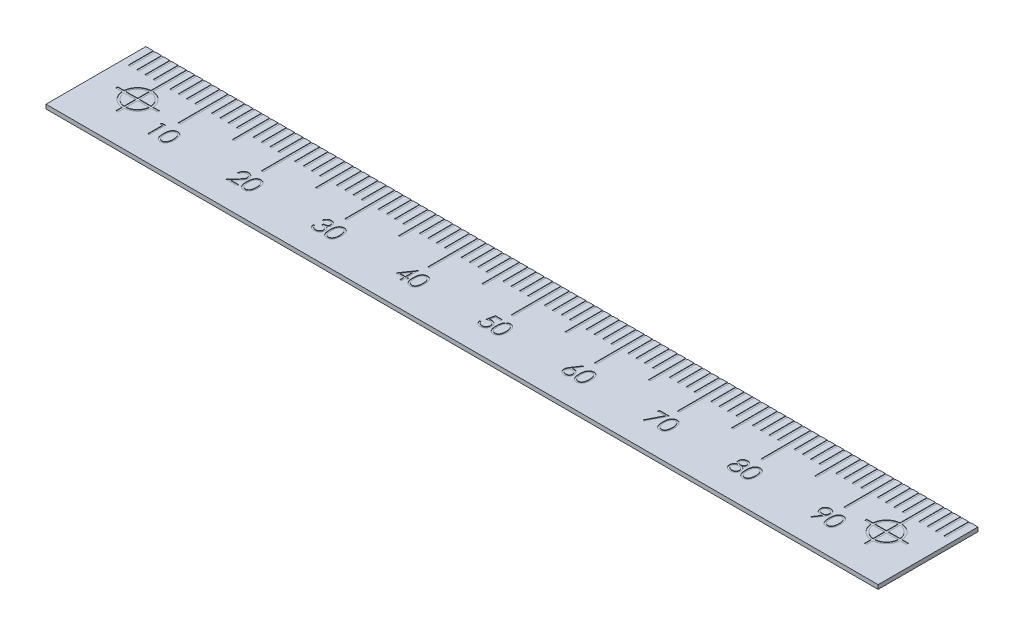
SolidWorks part; units mm, degrees
ref_plane "Front Plane" through (0, 0, 0) normal (0, 0, 1) x (1, 0, 0)
ref_plane "Top Plane" through (0, 0, 0) normal (0, 1, 0) x (1, 0, 0)
ref_plane "Right Plane" through (0, 0, 0) normal (1, 0, 0) x (0, 0, -1)
sketch "Sketch1" plane through (0, 0, 0) normal (0, 1, 0) x (1, 0, 0)
  line L1 (-50, 6) -> (50, 6)
  line L2 (-50, 6) -> (-50, -6)
  line L3 (-50, -6) -> (50, -6)
  line L4 (50, 6) -> (50, -6)
extrude "Boss-Extrude1" add sketch "Sketch1" against normal blind 0.5
sketch "Sketch2" plane through (0, 0, 0) normal (0, 1, 0) x (1, 0, 0)
  line L1 (-49.125, 3) -> (-48.875, 3)
  line L2 (-49.125, 3) -> (-49.125, 6)
  line L3 (-49.125, 6) -> (-48.875, 6)
  line L4 (-48.875, 3) -> (-48.875, 6)
  line L5 (-49, 6) -> (-49, 3) construction
  line L6 (-50, 6) -> (-50, -6) construction
  dimension "D1" = 3
  dimension "D2" = 0.25
  dimension "D3" = 1
extrude "Cut-Extrude2" cut sketch "Sketch2" against normal blind 0.05 contours L4 L3 L2 L1
pattern_linear "LPattern2" count 99 spacing 1 along (1, 0, 0) of "Cut-Extrude2"
sketch "Sketch3" plane through (0, 0, 0) normal (0, 1, 0) x (1, 0, 0)
  line L0 (-40.125, 3) -> (-40.125, 6) construction
  line L6 (-40.125, 3) -> (-39.875, 3)
  line L7 (-40.125, 3) -> (-40.125, 0)
  line L8 (-40.125, 0) -> (-39.875, 0)
  line L9 (-39.875, 3) -> (-39.875, 0)
  dimension "D1" = 0
  dimension "D2" = 0.25
  dimension "D4" = 3
extrude "Cut-Extrude3" cut sketch "Sketch3" against normal blind 0.05
pattern_linear "LPattern3" count 9 spacing 10 along (1, 0, 0) of "Cut-Extrude3"
sketch "Sketch4" plane through (0, 0, 0) normal (0, 1, 0) x (1, 0, 0)
  line L0 (-35.125, 3) -> (-35.125, 6) construction
  line L1 (-35.125, 3) -> (-34.875, 3)
  line L2 (-35.125, 3) -> (-35.125, 1.5)
  line L3 (-35.125, 1.5) -> (-34.875, 1.5)
  line L4 (-34.875, 3) -> (-34.875, 1.5)
  dimension "D1" = 0
  dimension "D2" = 0.25
  dimension "D3" = 3
  dimension "D4" = 1.5
extrude "Cut-Extrude4" cut sketch "Sketch4" against normal blind 0.05
pattern_linear "LPattern4" count 9 spacing 10 along (1, 0, 0) count 2 spacing 10 along (-1, 0, 0) of "Cut-Extrude4"
sketch "Sketch5" plane through (0, 0, 0) normal (0, 1, 0) x (1, 0, 0)
  line L0 (-44.995, 0) -> (-44.995, 2.5) construction
  line L1 (-44.995, 0) -> (-44.995, -2.5) construction
  line L2 (-44.995, 0) -> (-42.495, 0) construction
  line L3 (-44.995, 0) -> (-47.495, 0) construction
  line L5 (-45.12, 2.5) -> (-44.87, 2.5)
  line L6 (-45.12, 2.5) -> (-45.12, 1.7455)
  line L7 (-45.12, -2.5) -> (-44.87, -2.5)
  line L8 (-44.87, 2.5) -> (-44.87, 1.7455)
  line L9 (-47.495, 0.125) -> (-46.7405, 0.125)
  line L10 (-47.495, 0.125) -> (-47.495, -0.125)
  line L11 (-47.495, -0.125) -> (-46.7405, -0.125)
  line L12 (-42.495, 0.125) -> (-42.495, -0.125)
  line L13 (-48.125, 6) -> (-48.875, 6) construction
  line L14 (-45.12, 1.4948) -> (-45.12, 0.125)
  line L15 (-44.87, 1.4948) -> (-44.87, 0.125)
  line L16 (-43.2495, 0.125) -> (-42.495, 0.125)
  line L17 (-43.2495, -0.125) -> (-42.495, -0.125)
  line L18 (-44.87, -1.7455) -> (-44.87, -2.5)
  line L19 (-45.12, -1.7455) -> (-45.12, -2.5)
  line L20 (-46.4898, -0.125) -> (-45.12, -0.125)
  line L21 (-46.4898, 0.125) -> (-45.12, 0.125)
  line L22 (-44.87, -0.125) -> (-44.87, -1.4948)
  line L23 (-44.87, 0.125) -> (-43.5002, 0.125)
  line L24 (-45.12, -0.125) -> (-45.12, -1.4948)
  line L25 (-44.87, -0.125) -> (-43.5002, -0.125)
  arc A0 (-45.12, 1.4948) -> (-46.4898, 0.125) centre (-44.995, 0) ccw
  arc A1 (-45.12, 1.7455) -> (-46.7405, 0.125) centre (-44.995, 0) ccw
  arc A2 (-43.5002, 0.125) -> (-44.87, 1.4948) centre (-44.995, 0) ccw
  arc A3 (-43.2495, 0.125) -> (-44.87, 1.7455) centre (-44.995, 0) ccw
  arc A4 (-44.87, -1.4948) -> (-43.5002, -0.125) centre (-44.995, 0) ccw
  arc A5 (-44.87, -1.7455) -> (-43.2495, -0.125) centre (-44.995, 0) ccw
  arc A6 (-46.4898, -0.125) -> (-45.12, -1.4948) centre (-44.995, 0) ccw
  arc A7 (-46.7405, -0.125) -> (-45.12, -1.7455) centre (-44.995, 0) ccw
  point P34 (-44.995, 2.5)
extrude "Cut-Extrude6" cut sketch "Sketch5" against normal blind 0.05
pattern_linear "LPattern5" count 2 spacing 90 along (1, 0, 0) of "Cut-Extrude6"
sketch "Sketch7" plane through (0, 0, 0) normal (0, 1, 0) x (1, 0, 0)
  line L0 (-50, -6) -> (50, -6) construction
  line L1 (-50, 6) -> (-50, -6) construction
  text T0 "10         20         30         40" font "Century Gothic" height 2
  dimension "D1" = 3
  dimension "D2" = 8.5
extrude "Cut-Extrude7" cut sketch "Sketch7" against normal blind 0.05
sketch "Sketch11" plane through (0, 0, 0) normal (0, 1, 0) x (1, 0, 0)
  line L0 (-50, -6) -> (50, -6) construction
  line L1 (-50, 6) -> (-50, -6) construction
  text T0 "50         60         70         80         90" font "Century Gothic" height 2
  dimension "D1" = 3
  dimension "D2" = 48.5
extrude "Cut-Extrude8" cut sketch "Sketch11" against normal blind 0.05
sketch "Sketch14" plane through (0, 0, 0) normal (0, 1, 0) x (1, 0, 0)
  line L0 (-50, -6) -> (50, -6) construction
  line L1 (-50, 6) -> (-50, -6) construction
  text T0 "100       110       120       130       140" font "Century Gothic" height 2
  dimension "D1" = 3
  dimension "D2" = 97.5
extrude "Cut-Extrude10" [suppressed] cut sketch "Sketch14" against normal blind 0.05
sketch "Sketch15" plane through (0, 0, 0) normal (0, 1, 0) x (1, 0, 0)
  line L0 (-50, 6) -> (-50, -6) construction
  line L1 (-50, -6) -> (50, -6) construction
  text T0 "40         30         20         10" font "Century Gothic" height 2
  dimension "D1" = 108.5
  dimension "D2" = 3
extrude "Cut-Extrude12" [suppressed] cut sketch "Sketch15" against normal blind 0.05
sketch "Sketch18" plane through (0, 0, 0) normal (0, 1, 0) x (1, 0, 0)
  line L0 (-50, -6) -> (50, -6) construction
  line L1 (-50, 6) -> (-50, -6) construction
  text T0 "90         80         70         60         50" font "Century Gothic" height 2
  dimension "D1" = 3
  dimension "D2" = 8.5
extrude "Cut-Extrude13" [suppressed] cut sketch "Sketch18" against normal blind 0.05
sketch "Sketch19" plane through (0, 0, 0) normal (0, 1, 0) x (1, 0, 0)
  line L0 (-50, 6) -> (-50, -6) construction
  line L1 (-50, -6) -> (50, -6) construction
  text T0 "140       130       120       110       100" font "Century Gothic" height 2
  dimension "D1" = 7.5
  dimension "D2" = 3
extrude "Cut-Extrude14" [suppressed] cut sketch "Sketch19" against normal blind 0.05
sketch "Sketch20" plane through (0, 0, 0) normal (0, 1, 0) x (1, 0, 0)
  circle A0 centre (-44.995, 0) radius 1.75
extrude "Cut-Extrude15" [suppressed] cut sketch "Sketch20" against normal blind 0.5
pattern_linear "LPattern6" [suppressed] count 2 spacing 90
sketch "Sketch21" plane through (0, 0, 0) normal (0, 1, 0) x (1, 0, 0)
  line L0 (-50, -6) -> (50, -6) construction
  line L1 (-50, 6) -> (-50, -6) construction
  text T0 "10         20         30         40         50         40         30         20         10" font "Century Gothic" height 2
  dimension "D1" = 3
  dimension "D2" = 8.5
extrude "Cut-Extrude17" [suppressed] cut sketch "Sketch21" against normal blind 0.05
sketch "Sketch22" plane through (0, 0, 0) normal (0, 1, 0) x (1, 0, 0)
  line L0 (-50, -6) -> (50, -6) construction
  line L1 (-50, 6) -> (-50, -6) construction
  text T0 "10         20         30         40         50         60         70         80         90        100        90         80         70         60         50         40         30         20         10" font "Century Gothic" height 2
  dimension "D1" = 3
  dimension "D2" = 8.5
extrude "Cut-Extrude18" [suppressed] cut sketch "Sketch22" against normal blind 0.05
sketch "Sketch23" plane through (0, 0, 0) normal (0, 1, 0) x (1, 0, 0)
  line L0 (-50, -6) -> (50, -6) construction
  line L2 (-50, 6) -> (-50, -6) construction
  text T0 "10         20         30         40         50         60         70         80         90        100       110       120       130       140       150       160       170       180       190       20" font "Century Gothic" height 2
  dimension "D1" = 3
  dimension "D2" = 8.5
extrude "Cut-Extrude19" [suppressed] cut sketch "Sketch23" against normal blind 0.05
sketch "Sketch24" plane through (0, 0, 0) normal (0, 1, 0) x (1, 0, 0)
  line L0 (-50, -6) -> (50, -6) construction
  line L1 (-50, 6) -> (-50, -6) construction
  text T0 "10         20         30         40         50         60         70         80         90        100       110       120       130       140       150       160       170       180       190" font "Century Gothic" height 2
  dimension "D1" = 3
  dimension "D2" = 8.5
extrude "Cut-Extrude20" [suppressed] cut sketch "Sketch24" against normal blind 0.05
sketch "Sketch26" plane through (0, 0, 0) normal (0, 1, 0) x (1, 0, 0)
  line L0 (-50, -6) -> (50, -6) construction
  line L1 (-50, 6) -> (-50, -6) construction
  text T0 "190       180       170       160       150       140       130       120       110       100        90         80         70         60         50         40         30         20         10" font "Century Gothic" height 2
  dimension "D1" = 3
  dimension "D2" = 7.5
extrude "Cut-Extrude21" [suppressed] cut sketch "Sketch26" against normal blind 0.05
sketch "Sketch27" plane through (0, 0, 0) normal (0, 1, 0) x (1, 0, 0)
  line L0 (-50, -6) -> (50, -6) construction
  line L1 (-50, 6) -> (-50, -6) construction
  text T0 "490       480       470       460       450       440       430       420       410       400       390       380       370       360       350       340       330       320       310       300       " font "Century Gothic" height 2
  dimension "D1" = 3
  dimension "D2" = 7.5
extrude "Cut-Extrude22" [suppressed] cut sketch "Sketch27" against normal blind 0.05
sketch "Sketch29" plane through (0, 0, 0) normal (0, 1, 0) x (1, 0, 0)
  line L0 (-50, -6) -> (50, -6) construction
  line L1 (-50, 6) -> (-50, -6) construction
  text T0 "10         20         30         40         50         60         70         80         90        100       110       120       130       140       150       160       170       180       190       20" font "Century Gothic" height 2
  dimension "D1" = 3
  dimension "D2" = 8.5
extrude "Cut-Extrude23" [suppressed] cut sketch "Sketch29" against normal blind 0.05
sketch "Sketch30" plane through (0, 0, 0) normal (0, 1, 0) x (1, 0, 0)
  line L0 (-50, -6) -> (50, -6) construction
  line L1 (-50, 6) -> (-50, -6) construction
  text T0 "240       230       220       210       200       190       180       170       160       150       140       130       120       110       100        90         80         70         60         50   " font "Century Gothic" height 2
  dimension "D1" = 3
  dimension "D2" = 7.5
extrude "Cut-Extrude24" [suppressed] cut sketch "Sketch30" against normal blind 0.05
sketch "Sketch31" [suppressed] plane through (0, 0, 0) normal (0, 1, 0) x (1, 0, 0)
  line L0 (-100, -6) -> (100, -6) construction
  line L1 (-100, 6) -> (-100, -6) construction
  text T0 "150       160       170       180       190" font "Century Gothic" height 2
  dimension "D1" = 3
  dimension "D2" = 148.5
extrude "Cut-Extrude25" [suppressed] cut sketch "Sketch31" against normal blind 0.05
sketch "Sketch32" [suppressed] plane through (0, 0, 0) normal (0, 1, 0) x (1, 0, 0)
  line L0 (-25, -6) -> (25, -6) construction
  line L1 (-24.125, -6) -> (-23.875, -6)
  line L2 (-24.125, -6) -> (-24.125, -3)
  line L3 (-24.125, -3) -> (-23.875, -3)
  line L4 (-23.875, -6) -> (-23.875, -3)
  line L5 (-24, -3) -> (-24, -6) construction
  line L6 (-25, 6) -> (-25, -6) construction
  dimension "D1" = 0.25
  dimension "D2" = 3
  dimension "D3" = 1
extrude "Cut-Extrude26" [suppressed] cut sketch "Sketch32" against normal blind 0.05
pattern_linear "LPattern7" [suppressed] count 99 spacing 1
sketch "Sketch34" [suppressed] plane through (0, 0, 0) normal (0, 1, 0) x (1, 0, 0)
  line L1 (-245.125, -3) -> (-244.875, -3)
  line L2 (-245.125, -3) -> (-245.125, -1.5)
  line L3 (-245.125, -1.5) -> (-244.875, -1.5)
  line L4 (-244.875, -3) -> (-244.875, -1.5)
  dimension "D1" = 1.5
  dimension "D2" = 0.25
extrude "Cut-Extrude27" [suppressed] cut sketch "Sketch34" against normal blind 0.05
pattern_linear "LPattern8" [suppressed] count 4 spacing 10
sketch "Sketch35" [suppressed] plane through (0, 0, 0) normal (0, 1, 0) x (1, 0, 0)
  line L1 (-240.125, -3) -> (-239.875, -3)
  line L2 (-240.125, -3) -> (-240.125, 0)
  line L3 (-240.125, 0) -> (-239.875, 0)
  line L4 (-239.875, -3) -> (-239.875, 0)
  dimension "D1" = 3
  dimension "D2" = 0.25
extrude "Cut-Extrude28" [suppressed] cut sketch "Sketch35" against normal blind 0.05
pattern_linear "LPattern9" [suppressed] count 4 spacing 10
equation "\"D2@Sketch1\"=\"D1@Sketch1\"/2"
equation "\"D4@Sketch1\"=\"D3@Sketch1\"/2"
equation "\"D8@Sketch5\"=\"D7@Sketch5\"/2"
equation "\"D10@Sketch5\"=\"D9@Sketch5\"/2"
